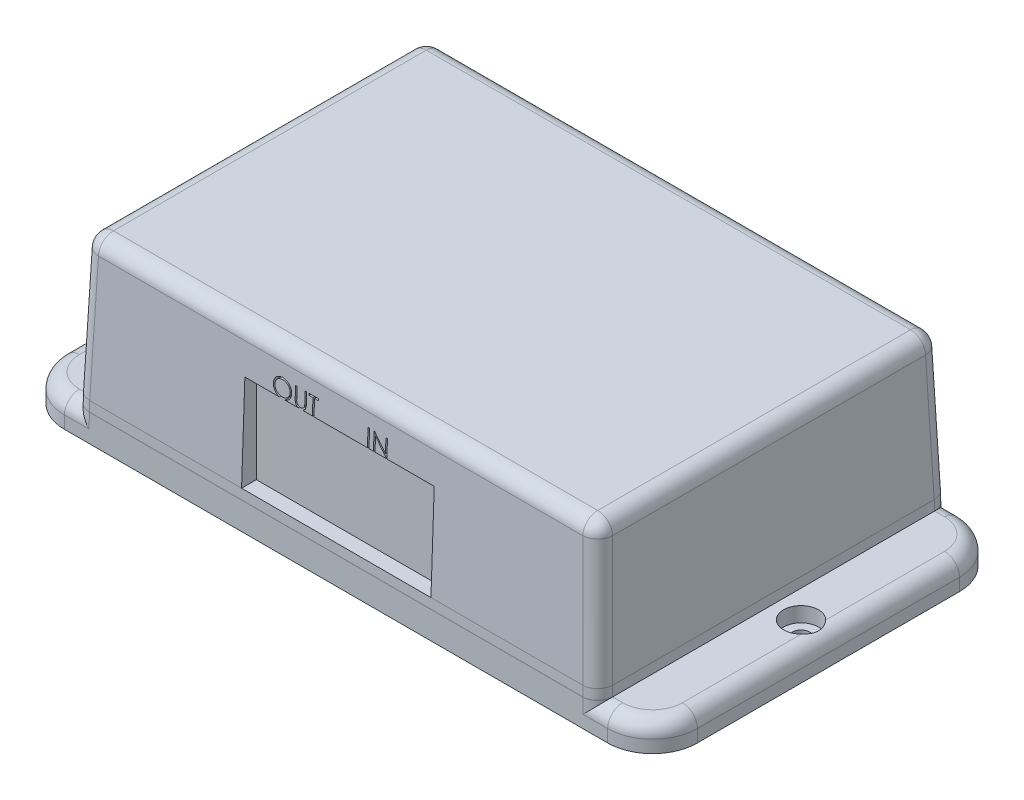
SolidWorks part; units mm, degrees
ref_plane "Front Plane" through (0, 0, 0) normal (0, 0, 1) x (1, 0, 0)
ref_plane "Top Plane" through (0, 0, 0) normal (0, 1, 0) x (1, 0, 0)
ref_plane "Right Plane" through (0, 0, 0) normal (1, 0, 0) x (0, 0, -1)
sketch "Sketch1" plane through (0, 0, 0) normal (0, 1, 0) x (1, 0, 0)
  line L0 (0, 0) -> (127, 0)
  line L1 (127, 0) -> (127, 70.6)
  line L2 (127, 70.6) -> (0, 70.6)
  line L3 (0, 70.6) -> (0, 0)
  dimension "D1" = 127
  dimension "D2" = 70.6
  dimension "D3" = 127
  dimension "D4" = 70.6
extrude "Boss-Extrude1" add sketch "Sketch1" along normal blind 5.5
sketch "Sketch2" plane through (0, 5.5, 0) normal (0, 1, 0) x (1, 0, 0)
  line L0 (63.5, 70.6) -> (116, 70.6)
  line L1 (127, 70.6) -> (0, 70.6) construction
  line L4 (116, 35.3) -> (116, 0)
  line L5 (0, 0) -> (127, 0) construction
  line L6 (116, 35.3) -> (116, 70.6)
  line L8 (11, 70.6) -> (11, 0)
  line L9 (11, 0) -> (116, 0)
  line L10 (11, 70.6) -> (63.5, 70.6)
  dimension "D3" = 35.3
  dimension "D4" = 35.3
  dimension "D6" = 70.6
  dimension "D7" = 105
  dimension "D8" = 52.5
extrude "Boss-Extrude2" add sketch "Sketch2" along normal blind 2 draft 1
sketch "Sketch3" plane through (0, 7.5, 0) normal (0, 1, 0) x (1, 0, 0)
  line L4 (115.9651, 70.5651) -> (11.0349, 70.5651)
  line L5 (11.0349, 70.5651) -> (11.0349, 0.0349)
  line L6 (11.0349, 0.0349) -> (115.9651, 0.0349)
  line L7 (115.9651, 0.0349) -> (115.9651, 70.5651)
  line L8 (115.9651, 70.5651) -> (11.0349, 70.5651)
  line L9 (11.0349, 70.5651) -> (11.0349, 0.0349)
  line L10 (11.0349, 0.0349) -> (115.9651, 0.0349)
  line L11 (115.9651, 0.0349) -> (115.9651, 70.5651)
  dimension "D1" = 0
extrude "Boss-Extrude3" add sketch "Sketch3" along normal blind 28 draft 2
fillet "Fillet3" radius 9 4 edges at (0, 2.75, -70.6) (127, 2.75, -70.6) (127, 2.75, 0) (0, 2.75, 0)
fillet "Fillet2" radius 3 12 edges at (63.5, 35.5, -1.0127) (12.0127, 35.5, -35.3) (63.5, 35.5, -69.5873) (114.9873, 35.5, -35.3) (115.4762, 21.5, -70.0762) (115.4762, 21.5, -0.5238) (11.5238, 21.5, -0.5238) (11.5238, 21.5, -70.0762)
fillet "Fillet6" radius 3 12 edges at (2.636, 5.5, -2.636) (0, 5.5, -35.3) (2.636, 5.5, -67.964) (124.364, 5.5, -67.964) (127, 5.5, -35.3) (124.364, 5.5, -2.636)
sketch "Sketch4" plane through (0, 5.5, 0) normal (0, 1, 0) x (1, 0, 0)
  line L0 (0, 35.3) -> (5.5, 35.3) construction
  line L1 (0, 9) -> (0, 61.6) construction
  line L2 (127, 35.3) -> (121.5, 35.3) construction
  line L3 (127, 61.6) -> (127, 9) construction
  circle A0 centre (5.5, 35.3) radius 1.75
  circle A1 centre (121.5, 35.3) radius 1.75
  dimension "D1" = 5.5
  dimension "D2" = 5.5
extrude "Cut-Extrude1" cut sketch "Sketch4" against normal blind 28
sketch "Sketch5" plane through (0, 5.5, 0) normal (0, 1, 0) x (1, 0, 0)
  circle A0 centre (5.5, 35.3) radius 3.5
  circle A1 centre (121.5, 35.3) radius 3.5
extrude "Cut-Extrude2" cut sketch "Sketch5" against normal blind 3
sketch "Sketch6" plane through (0, 0, 0) normal (0, 0, 1) x (1, 0, 0)
  line L0 (63.5, 7.5) -> (82.5, 7.5)
  line L1 (14.0345, 7.5) -> (112.9655, 7.5) construction
  line L2 (82.5, 7.5) -> (82.5, 26.5)
  line L3 (82.5, 26.5) -> (44.5, 26.5)
  line L4 (44.5, 26.5) -> (44.5, 7.5)
  line L5 (44.5, 7.5) -> (63.5, 7.5)
  dimension "D1" = 19
  dimension "D2" = 19
  dimension "D3" = 38
  dimension "D4" = 19
  dimension "D5" = 19
extrude "Cut-Extrude3" cut sketch "Sketch6" against normal blind 3
ref_plane "Plane1" through (127, 0, 0) normal (1, 0, 0) x (0, 0, -1)
ref_plane "Plane2" through (0, 0, -70.6) normal (0, 0, 1) x (1, 0, 0)
sketch "Sketch7" plane through (0, 0, -70.6) normal (0, 0, 1) x (1, 0, 0)
  line L0 (63.5, 7.5) -> (31, 7.5)
  line L1 (112.9655, 7.5) -> (14.0345, 7.5) construction
  line L2 (31, 7.5) -> (31, 19.8)
  line L3 (31, 19.8) -> (96, 19.8)
  line L4 (96, 19.8) -> (96, 7.5)
  line L5 (96, 7.5) -> (31, 7.5)
  line L6 (31, 7.5) -> (30.6442, 7.1302)
  dimension "D1" = 32.5
  dimension "D2" = 12.3
  dimension "D3" = 65
  dimension "D4" = 12.3
  dimension "D5" = 65
  dimension "D6" = 0.5132
extrude "Cut-Extrude4" cut sketch "Sketch7" along normal blind 3 contours L5 L4 L3 L2 L0
sketch "Sketch8" plane through (0, 0, -70.6) normal (0, 0, 1) x (1, 0, 0)
  text T0 "PWR    ID1    ID2    ID3   ID4"
extrude "Cut-Extrude5" cut sketch "Sketch8" along normal blind 3
sketch "Sketch9" plane through (0, 0, 0) normal (0, 0, 1) x (1, 0, 0)
  text T0 "    OUT       IN"
extrude "Cut-Extrude6" cut sketch "Sketch9" against normal blind 3
